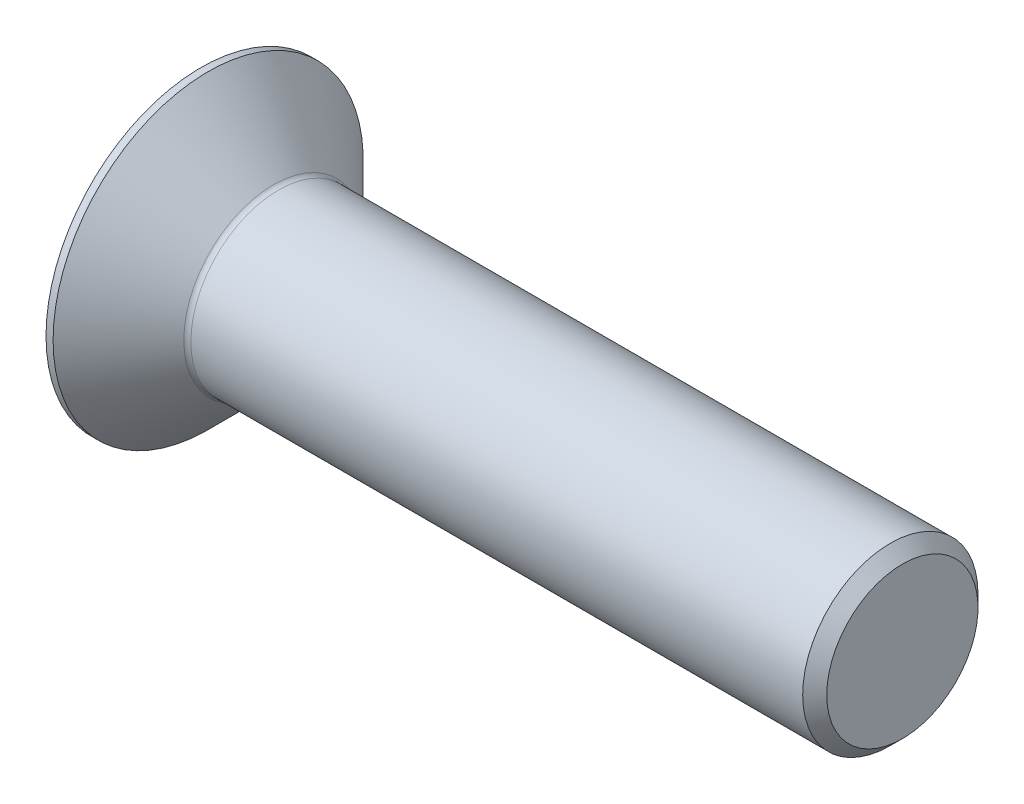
SolidWorks part; units mm, degrees
ref_plane "Plane1" through (0, 0, 0) normal (0, 0, 1) x (1, 0, 0)
ref_plane "Plane2" through (0, 0, 0) normal (0, 1, 0) x (1, 0, 0)
ref_plane "Plane3" through (0, 0, 0) normal (1, 0, 0) x (0, 0, -1)
sketch "BodySke" plane through (0, 0, 0) normal (0, 0, 1) x (1, 0, 0)
  line L0 (0, 0) -> (0, 17.69)
  line L1 (0.81, 17.69) -> (8.5, 10)
  line L2 (0, 17.69) -> (0.81, 17.69)
  line L3 (8.5, 10) -> (78.626, 10)
  line L4 (80, 8.626) -> (80, 0)
  line L5 (80, 0) -> (0, 0)
  line L6 (0, 0) -> (127, 0) construction
  line L7 (0.81, -17.69) -> (8.5, -10) construction
  line L8 (80, 8.626) -> (78.626, 10)
  line L9 (0, -17.69) -> (0.81, -17.69) construction
  line L10 (80, -8.626) -> (78.626, -10) construction
  line L11 (11, 16.35) -> (11, -5.875) construction
  line L12 (34, 16.35) -> (34, -5.875) construction
  dimension "Diameter" = 20
  dimension "Head_ht" = 8.5
  dimension "Length" = 80
  dimension "Body_ch_ang" = 45
  dimension "Head_dia" = 35.38
  dimension "Minor_dia" = 17.252
  dimension "Head_ang" = 90
  dimension "Advance" = 2.5
  dimension "Thread_nom" = 46
revolve "BaseBody" add sketch "BodySke" angle 360 about L6
fillet "Fillet1" radius 0.8 1 edges at (8.5, 0, 10)
sketch "Sketch2" plane through (0, 0, 0) normal (0, 0, 1) x (1, 0, 0)
  line L0 (0, 6) -> (5.6, 6)
  line L1 (5.6, 6) -> (9.0641, 0)
  line L2 (0, 0) -> (127, 0) construction
  line L3 (9.0641, 0) -> (0, 0)
  line L4 (0, 0) -> (0, 6)
  line L5 (0, -6) -> (5.6, -6) construction
  line L6 (0, 0) -> (47.625, 0) construction
  line L8 (0, 17.69) -> (0, -17.69) construction
  dimension "D2" = 60
  dimension "PreBroach_depth" = 5.6
  dimension "PreBroach_dia" = 12
revolve "PreBroach" cut sketch "Sketch2" angle 360 about L6
sketch "Sketch3" plane through (0, 0, 0) normal (-1, 0, 0) x (0, 0, 1)
  line L0 (-6, -3.4641) -> (-6, 3.4641)
  line L1 (-6, 3.4641) -> (0, 6.9282)
  line L2 (0, 6.9282) -> (6, 3.4641)
  line L3 (6, 3.4641) -> (6, -3.4641)
  line L4 (6, -3.4641) -> (0, -6.9282)
  line L5 (0, -6.9282) -> (-6, -3.4641)
  dimension "D1" = 6
  dimension "D2" = 6
  dimension "D3" = 12
  dimension "Hex_size" = 12
extrude "Hex" cut sketch "Sketch3" against normal blind 5.6
sketch "ThdSchSke" plane through (0, 0, 0) normal (0, 0, 1) x (1, 0, 0)
  line L0 (34, -8.626) -> (33.0379, -10)
  line L1 (34, -8.626) -> (34.9621, -10)
  line L2 (34.9621, -10) -> (34.9621, -12.5)
  line L3 (-3.175, 0) -> (5.1513, 0) construction
  line L4 (0, 17.69) -> (0, -17.69) construction
  line L5 (34.9621, -12.5) -> (33.0379, -12.5)
  line L6 (33.0379, -12.5) -> (33.0379, -10)
  dimension "Thread_minor" = 17.252
  dimension "Diameter" = 20
  dimension "Start" = 34
  dimension "SideAngle" = 55
  dimension "VeeAngle" = 70
  dimension "Overcut" = 25
revolve "ThreadSchematic" [suppressed] cut sketch "ThdSchSke" angle 360 about L3
pattern_linear "ThdSchPat" [suppressed]
equation "\"Thread_minor@ThreadCosmetic\"  =  \"Minor_dia@BodySke\""
equation "\"D1@Sketch3\" = \"Hex_size@Sketch3\" / 2"
equation "\"D2@Sketch3\" = \"D1@Sketch3\""
equation "\"D3@Sketch3\" = \"Hex_size@Sketch3\""
equation "\"Thread_length@ThreadCosmetic\" = ((sgn( (\"Length@BodySke\" - \"Advance@BodySke\" * 1.5 - \"Head_ht@BodySke\" ) - \"Thread_nom@BodySke\" )-1)*( (\"Length@BodySke\" - \"Advance@BodySke\" * 1.5 - \"Head_ht@BodySke\" "
equation "\"Thread_minor@ThdSchSke\" = \"Minor_dia@BodySke\""
equation "\"Diameter@ThdSchSke\" = \"Diameter@BodySke\""
equation "\"Overcut@ThdSchSke\" = \"Diameter@BodySke\" * 1.25"
equation "\"Start@ThdSchSke\" = 0.000001 + \"Length@BodySke\" - \"Thread_length@ThreadCosmetic\"  '---Countersunk---"
equation "\"Num_threads@ThdSchPat\" = int( \"Thread_length@ThreadCosmetic\" / \"Advance@BodySke\" + 0.999 )  + 1"
equation "\"Advance@ThdSchPat\" = \"Thread_length@ThreadCosmetic\" /  (\"Num_threads@ThdSchPat\" - 1) 'relax it"
equation "\"Num_threads@ThdSchPat\" = \"Num_threads@ThdSchPat\" - sgn( \"Num_threads@ThdSchPat\" - 1) '---chamfered tips only---"
